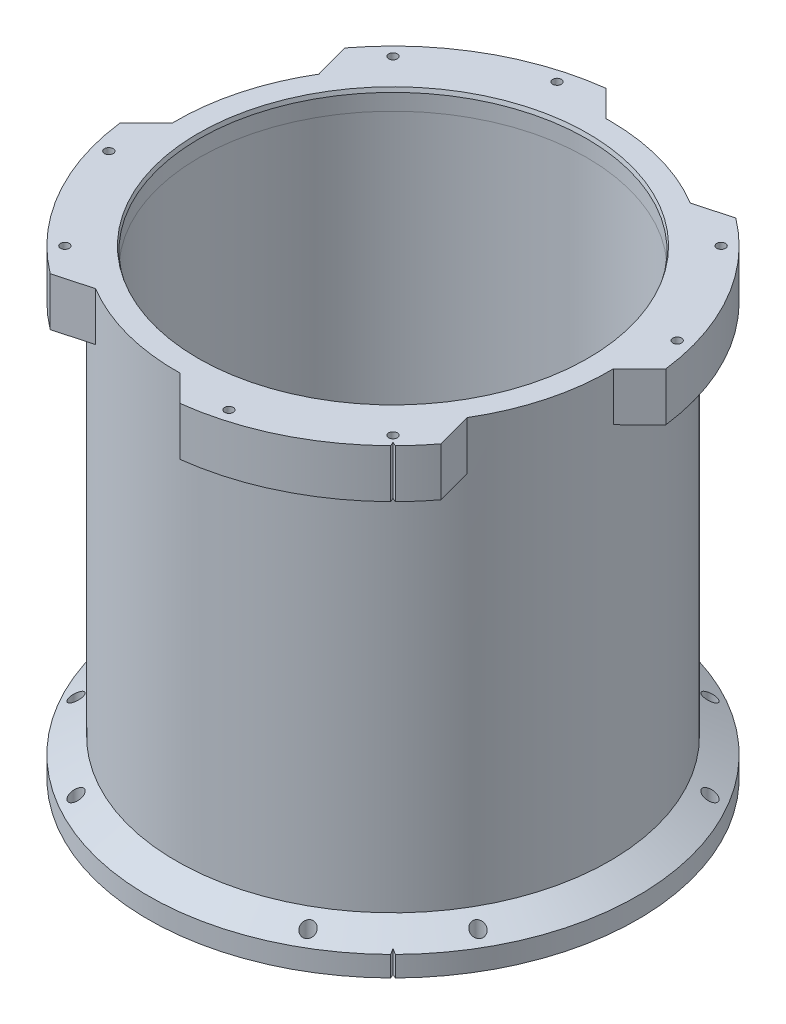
SolidWorks part; units mm, degrees
ref_plane "Front Plane" through (0, 0, 0) normal (0, 0, 1) x (1, 0, 0)
ref_plane "Top Plane" through (0, 0, 0) normal (0, 1, 0) x (1, 0, 0)
ref_plane "Right Plane" through (0, 0, 0) normal (1, 0, 0) x (0, 0, -1)
sketch "Sketch1" plane through (0, 0, 0) normal (0, 0, 1) x (1, 0, 0)
  line L0 (59.055, 0) -> (76.2, 0)
  line L1 (76.2, 0) -> (76.2, 6.35)
  line L2 (76.2, 6.35) -> (67.4688, 11.391)
  line L3 (60.325, 4.7625) -> (57.15, 1.5875)
  line L4 (60.325, 4.7625) -> (60.325, 143.51)
  line L5 (60.325, 143.51) -> (76.2, 143.51)
  line L6 (-1.5999, 0) -> (0, 0) construction
  line L7 (0, 0) -> (0, 48.9783) construction
  line L8 (57.15, 1.5875) -> (57.15, 0)
  line L9 (67.4688, 11.391) -> (67.4688, 128.4224)
  line L10 (57.15, 0) -> (59.055, 0)
  line L11 (67.4688, 128.4224) -> (76.2, 128.4224)
  line L12 (76.2, 128.4224) -> (76.2, 143.51)
  dimension "D1" = 120.65
  dimension "D2" = 11.391
  dimension "D3" = 17.145
  dimension "D5" = 6.35
  dimension "D4" = 152.4
  dimension "D6" = 7.1437
  dimension "D7" = 143.51
  dimension "D8" = 114.3
  dimension "D9" = 30
  dimension "D10" = 1.5875
  dimension "D11" = 45
  dimension "D12" = 15.0876
  dimension "D13" = 134.9375
revolve "Revolve1" add sketch "Sketch1" angle 360 about L7
hole_wizard "#10-32 Tapped Hole1" positions "Sketch3" profile "Sketch2" tap size "#10-32" standard "ANSI Inch"
sketch "Sketch3" plane through (0, 0, 0) normal (0, -1, 0) x (-1, 0, 0)
  line L0 (0, 0) -> (-269.4077, -269.4077) construction
  line L1 (0, 0) -> (0, -83.2072) construction
  line L2 (0, 0) -> (-36.1188, -62.5596) construction
  line L3 (0, 0) -> (-62.5596, -36.1188) construction
  circle A0 centre (0, 0) radius 72.2376 construction
  point P0 (-36.1188, -62.5596)
  point P17 (-62.5596, -36.1188)
  dimension "D2" = 144.4752
  dimension "D1" = 45
  dimension "D3" = 15
  dimension "D4" = 15
sketch "Sketch2" plane through (36.1188, 0, 62.5596) normal (1, 0, 0) x (0, 0, -1)
  line L0 (0, 0) -> (0, 12.4655)
  line L1 (0, 12.4655) -> (2.0193, 11.2522)
  line L2 (2.0193, 11.2522) -> (2.0193, 0)
  line L5 (2.0193, 0) -> (0, 0)
  line L10 (0, 12.4655) -> (-2.0193, 11.2522) construction
  line L11 (0, -6.35) -> (0, 107.95) construction
  dimension "Tap Drill Dia." = 4.0386
  dimension "Tap Drill Depth" = 11.2522
  dimension "Drill Angle" = 118
pattern_circular "CirPattern1" count 4 over 360 about axis through (0, 0, 0) along (0, 1, 0) of "#10-32 Tapped Hole1"
chamfer "Chamfer1" distance 1.27 angle 15 1 edges at (0, 143.51, -60.325)
hole_wizard "#6-32 Tapped Hole1" positions "Sketch5" profile "Sketch4" tap size "#6-32" standard "ANSI Inch"
sketch "Sketch5" plane through (0, 143.51, 0) normal (0, 1, 0) x (1, 0, 0)
  line L0 (0, 0) -> (51.0752, -51.0752) construction
  line L1 (0, 0) -> (0, -87.0135) construction
  circle A0 centre (0, 0) radius 72.2313 construction
  point P0 (51.0752, -51.0752)
  dimension "D1" = 144.4625
  dimension "D2" = 45
sketch "Sketch4" plane through (51.0752, 143.51, 51.0752) normal (1, 0, 0) x (0, 0, 1)
  line L0 (0, 0) -> (0, 19.6595)
  line L1 (0, 19.6595) -> (1.3525, 18.8468)
  line L2 (1.3525, 18.8468) -> (1.3525, 0)
  line L5 (1.3525, 0) -> (0, 0)
  line L10 (0, 19.6595) -> (-1.3526, 18.8468) construction
  line L11 (0, -6.35) -> (0, 107.95) construction
  dimension "Tap Drill Dia." = 2.7051
  dimension "Tap Drill Depth" = 18.8468
  dimension "Drill Angle" = 118
pattern_circular "CirPattern2" count 12 over 360 about axis through (0, 0, 0) along (0, 1, 0) of "#6-32 Tapped Hole1"
sketch "Sketch7" plane through (0, 0, 0) normal (1, 0, 0) x (0, 0, -1)
  line L0 (96.5375, 137.16) -> (-92.0989, 137.16)
  line L1 (67.4688, 143.51) -> (-67.4688, 143.51) construction
  dimension "D1" = 6.35
sketch "Sketch6" plane through (0, 0, 0) normal (0, 1, 0) x (1, 0, 0)
  line L1 (0, -115.8216) -> (184.0707, -115.8216)
  line L2 (0, -115.8216) -> (0, 0)
  line L3 (0, 0) -> (184.0707, 0)
  line L4 (184.0707, -115.8216) -> (184.0707, 0)
extrude "FEA Cut" [suppressed] cut sketch "Sketch6" along normal through all flip side to cut
sketch "Sketch8" plane through (0, 0, 0) normal (0, 1, 0) x (1, 0, 0)
  line L0 (0, 0) -> (61.6787, -61.6787) construction
  line L1 (52.9835, -52.9835) -> (65.2804, -58.077)
  line L2 (52.9835, -52.9835) -> (58.077, -65.2804)
  line L3 (58.077, -65.2804) -> (65.2804, -58.077)
  line L4 (0, 0) -> (92.6129, 0) construction
  dimension "D1" = 74.93
  dimension "D2" = 45
  dimension "D3" = 45
extrude "FWD Index Mark" cut sketch "Sketch8" along normal through all
sketch "Sketch9" plane through (0, 143.51, 0) normal (0, 1, 0) x (1, 0, 0)
  line L0 (0, 0) -> (99.1878, 0) construction
  line L1 (0, 0) -> (52.3462, -52.3462) construction
  line L2 (46.2483, -46.2483) -> (54.872, -49.6822)
  line L3 (46.2483, -46.2483) -> (49.9181, -54.7743)
  line L4 (49.9181, -54.7743) -> (52.3462, -52.3462)
  line L5 (52.3462, -52.3462) -> (54.872, -49.6822)
  dimension "D1" = 45
  dimension "D2" = 45
  dimension "D3" = 65.405
extrude "FWD Index Mark 2" [suppressed] cut sketch "Sketch9" against normal blind 6.35
sketch "Sketch10" plane through (0, 143.51, 0) normal (0, 1, 0) x (1, 0, 0)
  line L0 (-1.3114, 75.1307) -> (38.7011, 64.4094) construction
  line L1 (0, 0) -> (45.8583, 60.856) construction
  line L2 (0, 0) -> (-9.2864, 75.632) construction
  line L3 (18.6948, 69.77) -> (0, 0) construction
  line L4 (0, 0) -> (-1.3114, 75.1307) construction
  line L5 (0, 0) -> (38.7011, 64.4094) construction
  line L6 (34.749, 57.832) -> (45.8583, 60.856)
  line L7 (-1.1775, 67.4585) -> (-9.2864, 75.632)
  circle A0 centre (0, 0) radius 67.4688 construction
  arc A1 (34.749, 57.832) -> (-1.1775, 67.4585) centre (0, 0) ccw
  arc A2 (54.2517, -53.5088) -> (53.5088, -54.2517) centre (0, 0) ccw construction
  arc A3 (45.8583, 60.856) -> (-9.2864, 75.632) centre (0, 0) ccw
  dimension "D1" = 22
  dimension "D2" = 22
  dimension "D3" = 16
extrude "Cut-Extrude1" cut sketch "Sketch10" against normal up to next
pattern_circular "CirPattern3" count 4 over 360 about axis through (0, 0, 0) along (0, 1, 0) of "Cut-Extrude1"
equation "\"Buoyancy\"= \"SW-Volume\" * ( \"SW-Density\" - .037062 )"
